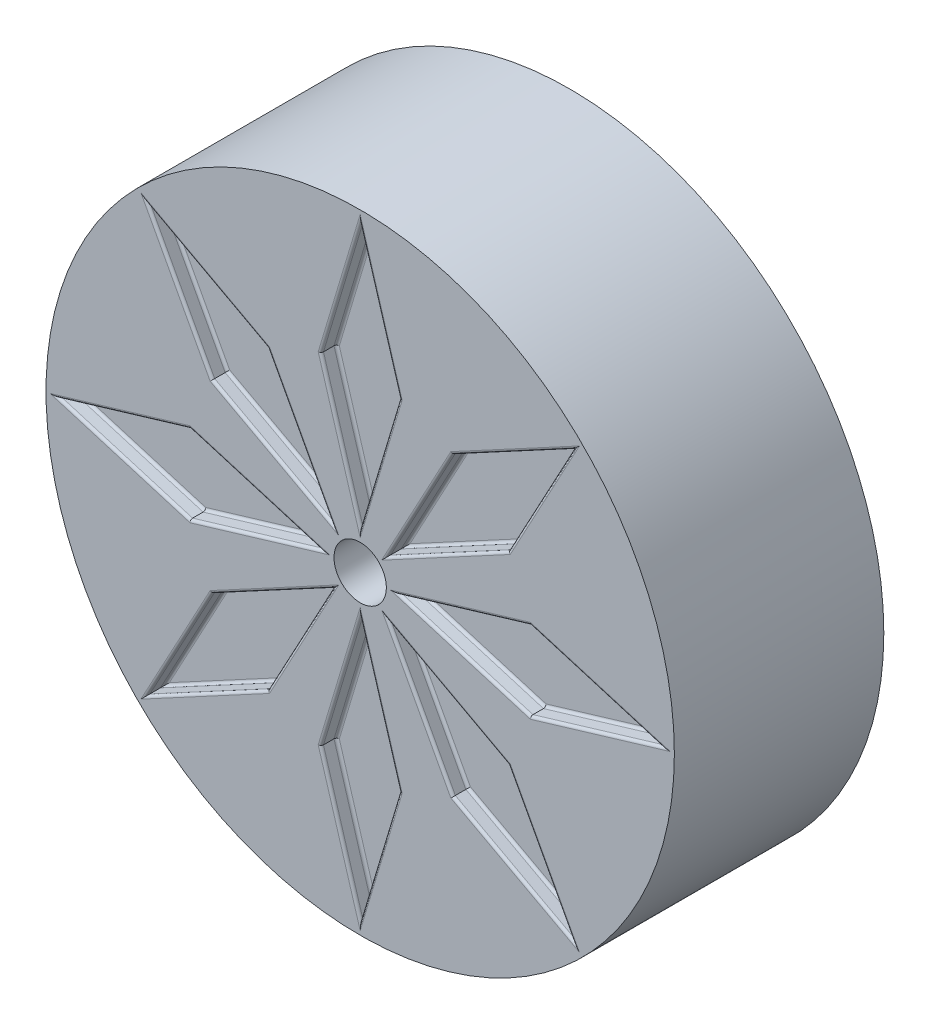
SolidWorks part; units mm, degrees
ref_plane "Front Plane" through (0, 0, 0) normal (0, 0, 1) x (1, 0, 0)
ref_plane "Top Plane" through (0, 0, 0) normal (0, 1, 0) x (1, 0, 0)
ref_plane "Right Plane" through (0, 0, 0) normal (1, 0, 0) x (0, 0, -1)
sketch "Sketch1" plane through (0, 0, 0) normal (0, 0, 1) x (1, 0, 0)
  circle A0 centre (0, 0) radius 152.4
  circle A1 centre (0, 0) radius 12.7
  dimension "D1" = 304.8
  dimension "D2" = 25.4
extrude "Boss-Extrude1" add sketch "Sketch1" along normal blind 101.6
sketch "Sketch2" plane through (0, 0, 101.6) normal (0, 0, 1) x (1, 0, 0)
  line L1 (0, 19.05) -> (19.05, 82.55)
  line L2 (19.05, 82.55) -> (0, 146.05)
  line L3 (0, 146.05) -> (-19.05, 82.55)
  line L4 (-19.05, 82.55) -> (0, 19.05)
  line L5 (0, 19.05) -> (0, 146.05) construction
  line L6 (19.05, 82.55) -> (-19.05, 82.55) construction
  dimension "D1" = 38.1
  dimension "D2" = 127
  dimension "D3" = 19.05
  dimension "D4" = 63.5
  dimension "D5" = 19.05
extrude "Cut-Extrude1" cut sketch "Sketch2" against normal blind 7.62
fillet "Fillet1" radius 1.27 8 edges at (-9.525, 114.3, 93.98) (9.525, 114.3, 93.98) (9.525, 50.8, 93.98) (-9.525, 50.8, 93.98) (9.525, 50.8, 101.6) (9.525, 114.3, 101.6) (-9.525, 114.3, 101.6) (-9.525, 50.8, 101.6)
pattern_circular "CirPattern1" count 8 every 45 about axis through (0, 0, 0) along (0, 0, 1) of "Cut-Extrude1", "Fillet1"
